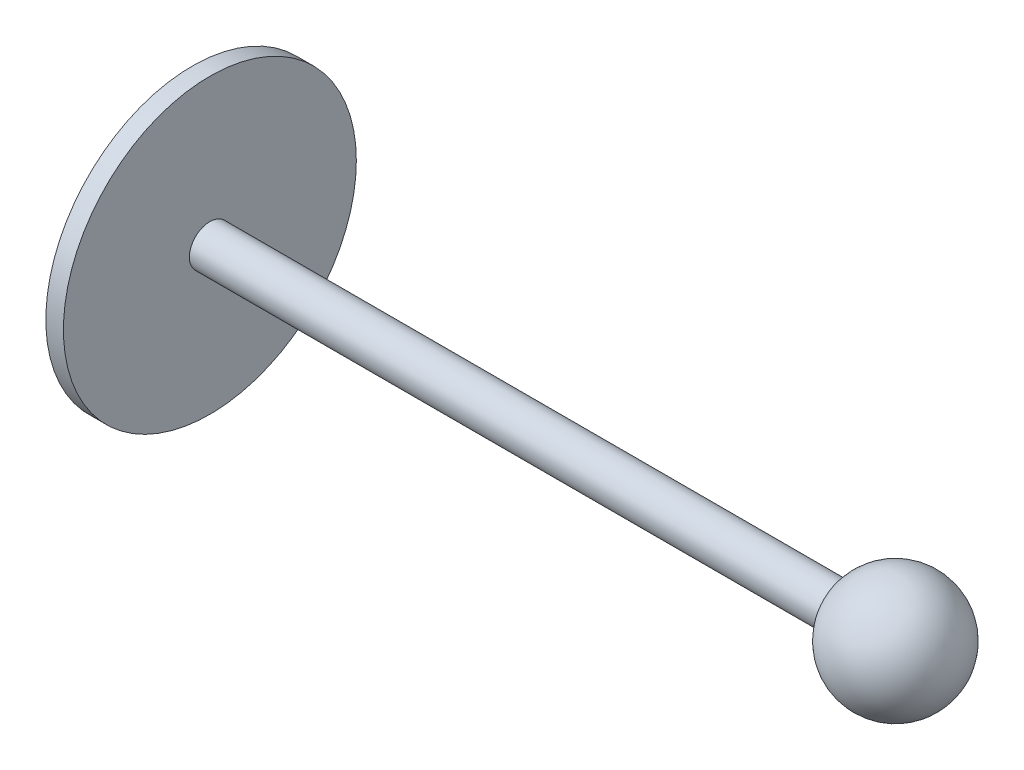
SolidWorks part; units mm, degrees
ref_plane "Face" through (0, 0, 0) normal (0, 0, 1) x (1, 0, 0)
ref_plane "Dessus" through (0, 0, 0) normal (0, 1, 0) x (1, 0, 0)
ref_plane "Droite" through (0, 0, 0) normal (1, 0, 0) x (0, 0, -1)
sketch "Esquisse1" plane through (0, 0, 0) normal (0, 0, 1) x (1, 0, 0)
  line L0 (38.7384, 0) -> (-130.5445, 0) construction
  line L1 (-9.3675, 3.5) -> (-117, 3.5)
  line L2 (-117, 3.5) -> (-117, 25)
  line L3 (-117, 25) -> (-120, 25)
  line L4 (-120, 25) -> (-120, 0)
  line L5 (-120, 0) -> (10, 0)
  arc A0 (10, 0) -> (-9.3675, 3.5) centre (0, 0) ccw
  dimension "D1" = 20
  dimension "D2" = 3.5
  dimension "D3" = 3
  dimension "D4" = 25
  dimension "D5" = 120
revolve "Révolution1" add sketch "Esquisse1" angle 360 about L0
